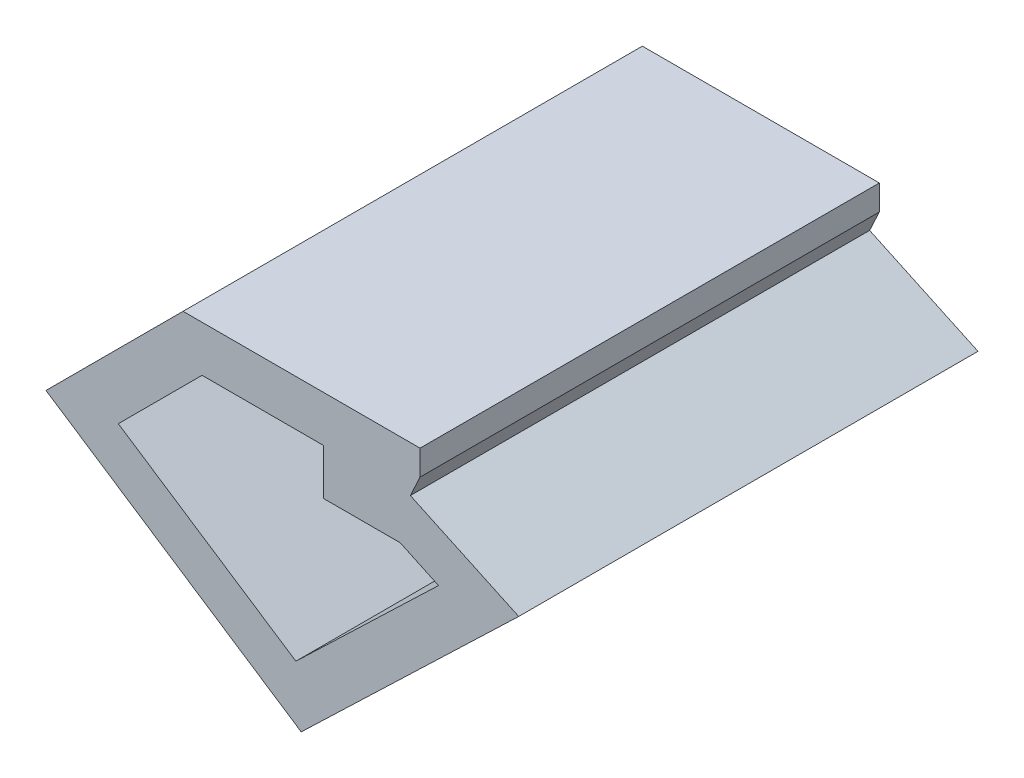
SolidWorks part; units mm, degrees
ref_plane "Front" through (0, 0, 0) normal (0, 0, 1) x (1, 0, 0)
ref_plane "Top" through (0, 0, 0) normal (0, 1, 0) x (1, 0, 0)
ref_plane "Right" through (0, 0, 0) normal (1, 0, 0) x (0, 0, -1)
sketch "Sketch1" plane through (0, 0, 0) normal (0, 0, 1) x (1, 0, 0)
  line L0 (-7.5, 0) -> (7.5, 0)
  line L1 (7.5, 0) -> (16.5631, -4.2262)
  line L2 (16.5631, -4.2262) -> (2.1312, -18.0726)
  line L3 (2.1312, -18.0726) -> (-14.5711, -7.0711)
  line L4 (-14.5711, -7.0711) -> (-7.5, 0)
  dimension "D1" = 15
  dimension "D2" = 10
  dimension "D3" = 20
  dimension "D4" = 20
  dimension "D5" = 10
  dimension "D6" = 25
  dimension "D7" = 135
sketch "Sketch2" plane through (0, 0, 0) normal (0, 0, 1) x (1, 0, 0)
  line L0 (8.265, 1.6405) -> (6.8661, -1.3595)
  line L1 (-14.3306, -4.7093) -> (-12.2093, -6.8306) construction
  line L2 (7.5, 0) -> (16.5631, -4.2262) construction
  line L3 (8.265, 1.6405) -> (-7.9808, 1.6405)
  line L4 (-7.9808, 1.6405) -> (-16.9329, -7.3116)
  line L5 (-16.9329, -7.3116) -> (-0.2635, -18.2914)
  line L6 (-0.2635, -18.2914) -> (13.9442, -4.6601)
  line L7 (13.9442, -4.6601) -> (6.8661, -1.3595)
  line L8 (16.5631, -4.2262) -> (2.1312, -18.0726) construction
  line L9 (2.1312, -18.0726) -> (-14.5711, -7.0711) construction
  line L10 (-14.5711, -7.0711) -> (-7.5, 0) construction
  line L11 (-12.2093, -6.8306) -> (-6.7381, -1.3595)
  line L12 (-6.7381, -1.3595) -> (6.8661, -1.3595)
  line L13 (-12.2093, -6.8306) -> (1.9566, -16.1614)
  line L14 (1.201, -1.3595) -> (1.201, -4.3595)
  line L15 (1.201, -4.3595) -> (6.201, -4.3595)
  line L16 (6.201, -4.3595) -> (8.7065, -5.5278)
  line L17 (8.7065, -5.5278) -> (-0.6127, -14.469)
  line L18 (0, 1.6405) -> (0, -1.3595) construction
  line L19 (-7.5, 0) -> (-14.5711, -7.0711) construction
  line L20 (-14.5711, -7.0711) -> (2.1312, -18.0726) construction
  line L21 (-13.8595, -9.3359) -> (-12.2093, -6.8306) construction
  line L22 (8.7065, -5.5278) -> (10.7835, -7.6926) construction
  line L23 (8.7065, -5.5278) -> (9.9744, -2.8089) construction
  line L24 (7.5, 0) -> (7.5, 1.6405)
  dimension "D1" = 1.5
  dimension "D2" = 1.5
  dimension "D3" = 3
  dimension "D4" = 5
extrude "Boss-Extrude1" add sketch "Sketch2" along normal mid plane 30 contours L13 L11 L12 L0 L3 L4 L5 L6 | L16 L17 L13 L6 L7 L12 L14 L15
